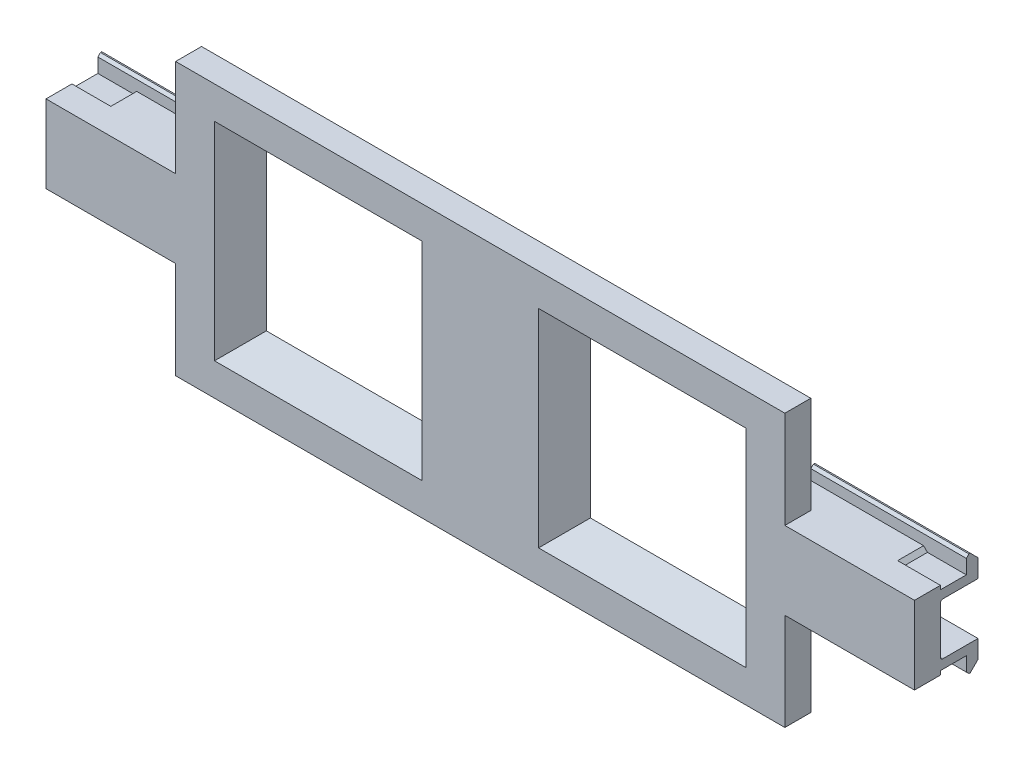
SolidWorks part; units mm, degrees
ref_plane "Plan de face" through (0, 0, 0) normal (0, 0, 1) x (1, 0, 0)
ref_plane "Plan de dessus" through (0, 0, 0) normal (0, 1, 0) x (1, 0, 0)
ref_plane "Plan de droite" through (0, 0, 0) normal (1, 0, 0) x (0, 0, -1)
sketch "Esquisse1" plane through (0, 0, 0) normal (0, 0, 1) x (1, 0, 0)
  line L0 (-23.5, -3) -> (-23.5, -10.5)
  line L1 (-23.5, 10.5) -> (23.5, 10.5)
  line L2 (-23.5, 10.5) -> (-23.5, 3)
  line L3 (-23.5, -10.5) -> (23.5, -10.5)
  line L4 (23.5, 10.5) -> (23.5, 3)
  line L5 (23.5, 3) -> (33.5, 3)
  line L7 (23.5, -3) -> (33.5, -3)
  line L8 (33.5, 3) -> (33.5, -3)
  line L9 (-23.5, 3) -> (-33.5, 3)
  line L11 (-23.5, -3) -> (-33.5, -3)
  line L12 (-33.5, 3) -> (-33.5, -3)
  line L13 (23.5, -3) -> (23.5, -10.5)
  dimension "D1" = 47
  dimension "D2" = 21
  dimension "D3" = 10.5
  dimension "D4" = 23.5
  dimension "D5" = 6
  dimension "D6" = 6
  dimension "D7" = 3
  dimension "D8" = 3
  dimension "D9" = 10
  dimension "D10" = 10
extrude "Boss.-Extru.1" add sketch "Esquisse1" along normal blind 2
sketch "Esquisse2" plane through (33.5, 0, 0) normal (1, 0, 0) x (0, 0, -1)
  line L0 (0, 3) -> (2, 3)
  line L1 (2, 3) -> (2, 4)
  line L4 (2.9, 4) -> (2.9, 2)
  line L5 (2.9, 2) -> (0, 2)
  line L6 (0, -3) -> (0, 3) construction
  line L7 (0, 2) -> (0, 3)
  line L8 (2, 4) -> (2.9, 4)
  line L10 (0, 3) -> (0, 10.5) construction
  point P15 (2, 3.5)
  dimension "D1" = 1
  dimension "D2" = 2
  dimension "D3" = 1
  dimension "D4" = 0.9
extrude "Boss.-Extru.2" add sketch "Esquisse2" against normal blind 12
chamfer "Chanfrein1" distance 0.6 angle 45 1 edges at (27.5, 4, -2.9)
chamfer "Chanfrein2" distance 0.2 angle 45 1 edges at (27.5, 4, -2)
fillet "Congé1" radius 0.2 2 edges at (27.5, 2, 0) (21.5, 2.5, 0)
sketch "Esquisse4" plane through (0, 3, 0) normal (0, 1, 0) x (1, 0, 0)
  line L0 (33.5, 2) -> (30.5, 2)
  line L1 (33.5, 2) -> (21.5, 2) construction
  line L2 (30.5, 2) -> (30.5, 0)
  line L3 (30.5, 0) -> (33.5, 0)
  line L6 (33.5, 0) -> (33.5, 2)
  line L10 (21.3, 0) -> (23.5, 0) construction
  point P13 (33.5, -2)
  point P14 (0, 0)
  dimension "D1" = 3
extrude "Enlèv. mat.-Extru.2" cut sketch "Esquisse4" against normal blind 0.3
chamfer "Chanfrein4" distance 0.3 angle 45 1 edges at (30.5, 3, -1)
pattern_linear "Répétition linéaire1" count 2 spacing 55 along (-1, 0, 0) of "Boss.-Extru.2", "Chanfrein1", "Chanfrein2", "Congé1"
mirror "Symétrie2" about plane through (0, 0, 0) normal (1, 0, 0) of "Enlèv. mat.-Extru.2"
mirror "Symétrie1" about plane through (0, 0, 0) normal (0, 1, 0) of "Symétrie2", "Répétition linéaire1", "Boss.-Extru.2", "Chanfrein1", "Chanfrein2", "Congé1", "Enlèv. mat.-Extru.2"
sketch "Esquisse5" plane through (0, 0, 2) normal (0, 0, 1) x (1, 0, 0)
  line L0 (23.5, 3) -> (23.5, 10.5) construction
  line L1 (6.5, 6) -> (18.5, 6)
  line L2 (6.5, 6) -> (6.5, -6)
  line L3 (6.5, -6) -> (18.5, -6)
  line L4 (18.5, 6) -> (18.5, -6)
  line L5 (2.695, 0) -> (-2.695, 0) construction
  dimension "D1" = 12
  dimension "D2" = 12
  dimension "D3" = 17
  dimension "D4" = 6
extrude "Enlèv. mat.-Extru.3" cut sketch "Esquisse5" against normal through all
chamfer "Chanfrein5" distance 2 angle 45 4 edges at (6.5, 0, 2) (12.5, -6, 2) (18.5, 0, 2) (12.5, 6, 2)
mirror "Symétrie3" about plane through (0, 0, 0) normal (1, 0, 0) of "Chanfrein5", "Enlèv. mat.-Extru.3"
